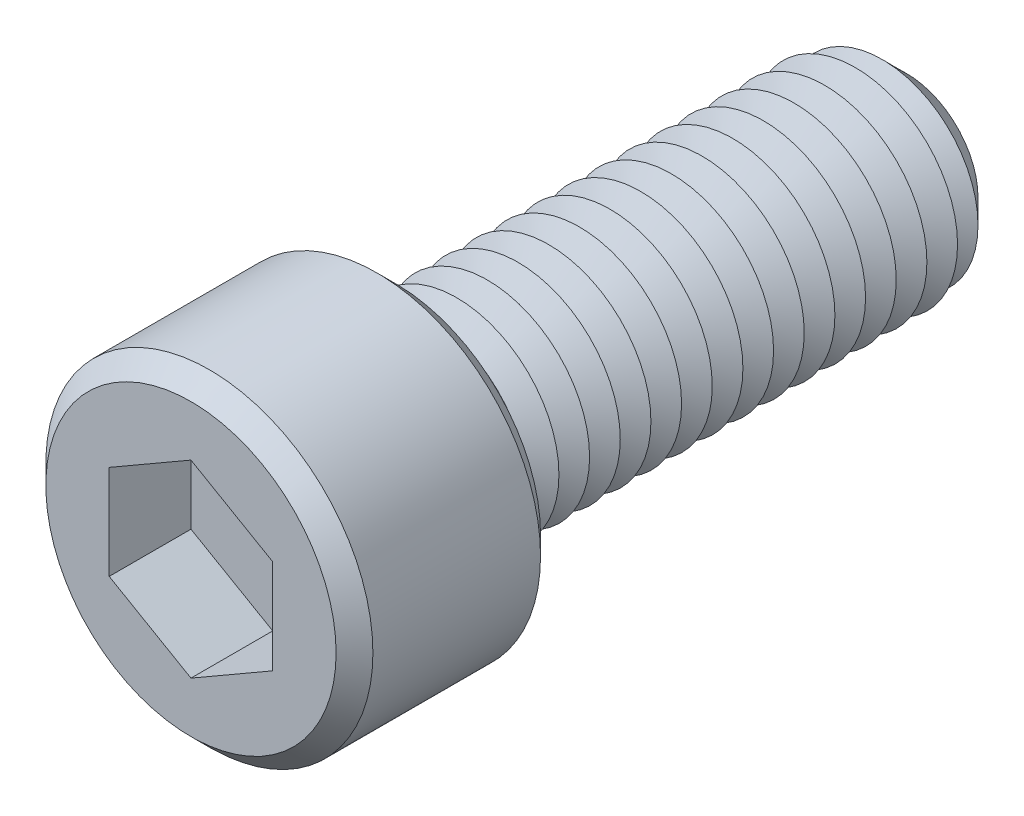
SolidWorks part; units mm, degrees
ref_plane "Front Plane" through (0, 0, 0) normal (0, 0, 1) x (1, 0, 0)
ref_plane "Top Plane" through (0, 0, 0) normal (0, 1, 0) x (1, 0, 0)
ref_plane "Right Plane" through (0, 0, 0) normal (1, 0, 0) x (0, 0, -1)
sketch "Sketch1" plane through (0, 0, 0) normal (0, 0, 1) x (1, 0, 0)
  circle A0 centre (0, 0) radius 8
  dimension "D1" = 16
extrude "Boss-Extrude1" add sketch "Sketch1" along normal blind 10
sketch "Sketch2" plane through (0, 0, 0) normal (0, 0, -1) x (-1, 0, 0)
  circle A0 centre (0, 0) radius 5
  dimension "D1" = 10
extrude "Boss-Extrude2" add sketch "Sketch2" along normal blind 25
chamfer "Chamfer1" distance 1.5 angle 45 1 edges at (-5, 0, -25)
sketch "Sketch3" plane through (0, 0, 0) normal (1, 0, 0) x (0, 0, -1)
  line L0 (-2.5121, 0) -> (4.5776, 0) construction
sketch "Sketch4" plane through (0, 0, 0) normal (1, 0, 0) x (0, 0, -1)
  line L0 (0, 5) -> (0.75, 3.701)
  line L1 (0.75, 3.701) -> (1.5, 5)
  line L2 (23.5, 5) -> (0, 5) construction
  line L3 (1.5, 5) -> (0, 5)
  dimension "D1" = 1.5
revolve "Cut-Revolve1" cut sketch "Sketch4" angle 360 about L0
pattern_linear "LPattern1" count 16 spacing 1.5 along (0, 0, -1) of "Cut-Revolve1"
sketch "Sketch5" plane through (0, 0, 10) normal (0, 0, 1) x (1, 0, 0)
  line L1 (0, 4.6188) -> (-4, 2.3094)
  line L2 (-4, 2.3094) -> (-4, -2.3094)
  line L3 (-4, -2.3094) -> (0, -4.6188)
  line L4 (0, -4.6188) -> (4, -2.3094)
  line L5 (4, -2.3094) -> (4, 2.3094)
  line L6 (4, 2.3094) -> (0, 4.6188)
  circle A0 centre (0, 0) radius 4 construction
  dimension "D1" = 8
extrude "Cut-Extrude1" cut sketch "Sketch5" against normal blind 4
sketch "Sketch6" plane through (0, 0, 6) normal (0, 0, 1) x (1, 0, 0)
  circle A0 centre (0, 0) radius 0.9
  dimension "D1" = 1.8
extrude "Cut-Extrude2" cut sketch "Sketch6" against normal up to surface (31 mm away)
chamfer "Chamfer2" distance 0.9 angle 45 2 edges at (8, 0, 0) (8, 0, 10)
